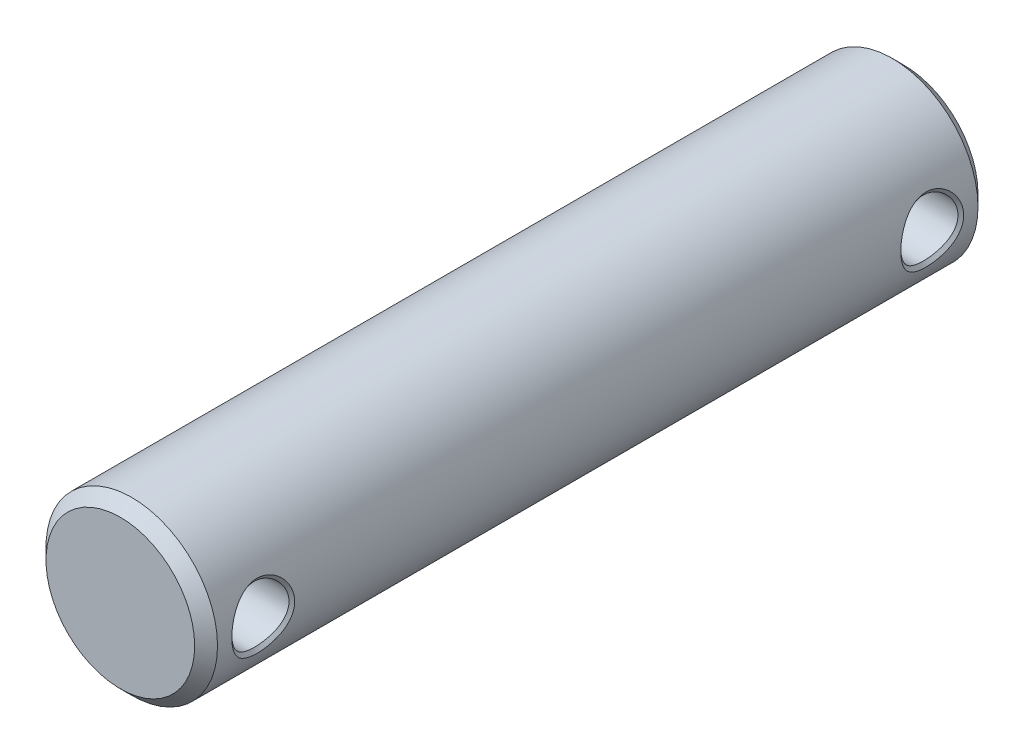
SolidWorks part; units mm, degrees
ref_plane "Plan de face" through (0, 0, 0) normal (0, 0, 1) x (1, 0, 0)
ref_plane "Plan de dessus" through (0, 0, 0) normal (0, 1, 0) x (1, 0, 0)
ref_plane "Plan de droite" through (0, 0, 0) normal (1, 0, 0) x (0, 0, -1)
sketch "Esquisse1" plane through (0, 0, 0) normal (0, 0, 1) x (1, 0, 0)
  circle A0 centre (0, 0) radius 15
  dimension "D1" = 30
extrude "Extrusion1" add sketch "Esquisse1" along normal blind 137
chamfer "Chanfrein1" distance 2 angle 45 2 edges at (15, 0, 137) (15, 0, 0)
sketch "Esquisse2" plane through (0, 0, 0) normal (1, 0, 0) x (0, 0, -1)
  line L0 (-137, 13) -> (-137, -13) construction
  line L1 (0, -13) -> (0, 13) construction
  circle A0 centre (-127, 0) radius 5
  circle A1 centre (-10, 0) radius 5
  dimension "D1" = 10
  dimension "D3" = 10
  dimension "D2" = 10
extrude "Enlèv. mat.-Extru.1" cut sketch "Esquisse2" against normal mid plane 166
chamfer "Chanfrein2" distance 0.5 angle 45 4 edges at (-14.9759, 0.8497, 122.0727) (14.9759, 0.8497, 131.9273) (-14.9759, 0.8497, 5.0727) (14.9759, 0.8497, 14.9273)
